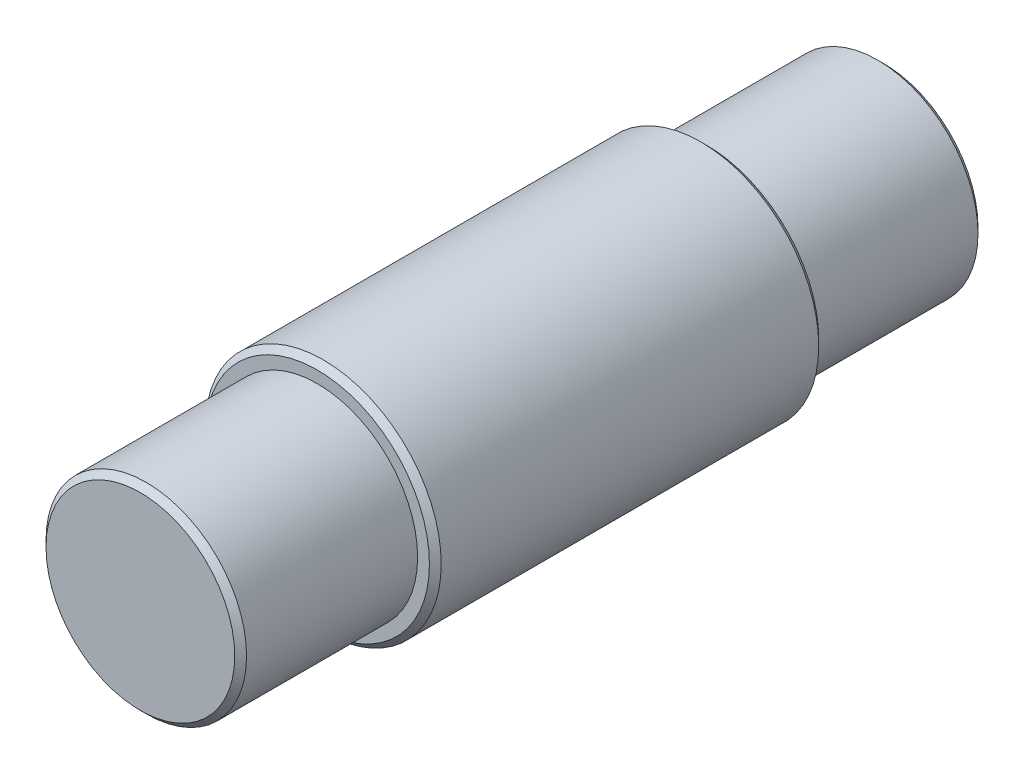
SolidWorks part; units mm, degrees
ref_plane "Front Plane" through (0, 0, 0) normal (0, 0, 1) x (1, 0, 0)
ref_plane "Top Plane" through (0, 0, 0) normal (0, 1, 0) x (1, 0, 0)
ref_plane "Right Plane" through (0, 0, 0) normal (1, 0, 0) x (0, 0, -1)
sketch "Sketch1" plane through (0, 0, 0) normal (0, 1, 0) x (1, 0, 0)
  line L0 (8, 13) -> (0, 13)
  line L1 (0, 13) -> (0, -50)
  line L2 (0, -50) -> (8, -50)
  line L3 (8, -50) -> (8.5, -49.5)
  line L4 (8.5, -49.5) -> (8.5, -35)
  line L5 (8.5, -35) -> (9.5, -35)
  line L6 (9.5, -35) -> (10, -34.5)
  line L7 (10, -34.5) -> (10, -2.5)
  line L8 (10, -2.5) -> (9.5, -2)
  line L9 (9.5, -2) -> (8.5, -2)
  line L10 (8.5, -2) -> (8.5, 12.5)
  line L11 (8.5, 12.5) -> (8, 13)
  line L12 (0, 13) -> (0, -50) construction
  dimension "D1" = 8
  dimension "D2" = 8.5
  dimension "D3" = 9.5
  dimension "D4" = 10
  dimension "D5" = 0.5
  dimension "D6" = 15
  dimension "D7" = 15.5
  dimension "D8" = 47.5
  dimension "D9" = 33
  dimension "D10" = 62.5
  dimension "D11" = 63
revolve "Revolve1" add sketch "Sketch1" angle 360 about L12
